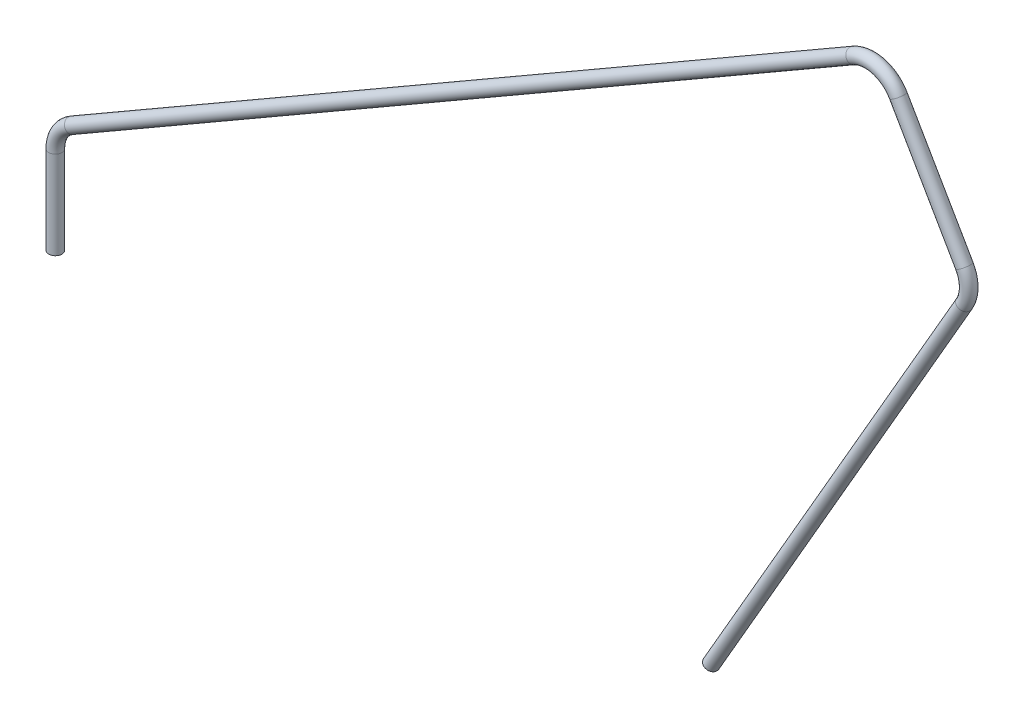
SolidWorks part; units mm, degrees
ref_plane "Plan de face" through (0, 0, 0) normal (0, 0, 1) x (1, 0, 0)
ref_plane "Plan de dessus" through (0, 0, 0) normal (0, 1, 0) x (1, 0, 0)
ref_plane "Plan de droite" through (0, 0, 0) normal (1, 0, 0) x (0, 0, -1)
sketch "Esquisse1" plane through (0, 0, 0) normal (0, 0, 1) x (1, 0, 0)
  line L0 (0, 0) -> (0, 40)
  line L1 (7.5, 52.9904) -> (362.5704, 257.9904)
  line L2 (383.0608, 252.5) -> (413.0608, 200.5385)
  line L3 (413.0608, 185.5385) -> (298.0608, -13.6474)
  arc A0 (413.0608, 185.5385) -> (413.0608, 200.5385) centre (400.0704, 193.0385) ccw
  arc A1 (383.0608, 252.5) -> (362.5704, 257.9904) centre (370.0704, 245) ccw
  arc A2 (7.5, 52.9904) -> (0, 40) centre (15, 40) ccw
  point P8 (417.3909, 193.0385)
  point P11 (375.5608, 265.4904)
  point P14 (0, 48.6603)
  dimension "D7" = 15
  dimension "D1" = 120
  dimension "D2" = 120
  dimension "D3" = 40
  dimension "D4" = 410
  dimension "D5" = 60
  dimension "D6" = 230
ref_plane "Plan1" through (0, 0, 0) normal (0, 1, 0) x (1, 0, 0)
sketch "Esquisse2" plane through (0, 0, 0) normal (0, 1, 0) x (1, 0, 0)
  line L0 (3, 0) -> (-8.3561, 0) construction
  circle A0 centre (0, 0) radius 3
  point P3 (3, 0)
  point P6 (-3, 0)
  dimension "D1" = 6
sweep "Balayage1" add profiles "Esquisse2" path "Esquisse1"
